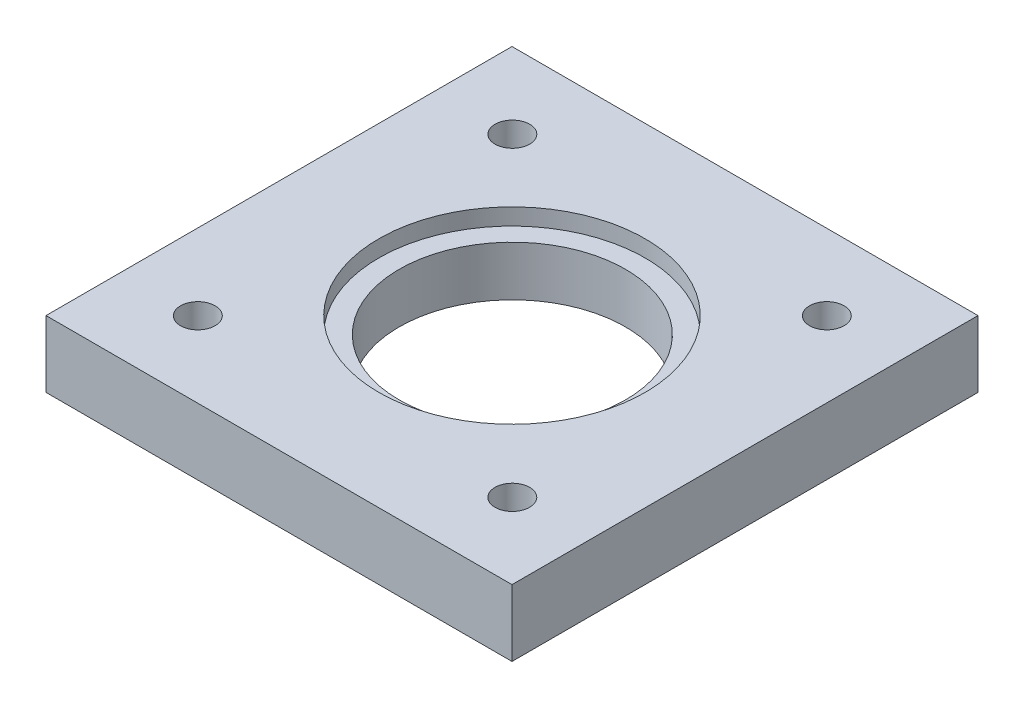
SolidWorks part; units mm, degrees
ref_plane "Front Plane" through (0, 0, 0) normal (0, 0, 1) x (1, 0, 0)
ref_plane "Top Plane" through (0, 0, 0) normal (0, 1, 0) x (1, 0, 0)
ref_plane "Right Plane" through (0, 0, 0) normal (1, 0, 0) x (0, 0, -1)
sketch "Sketch1" plane through (0, 0, 0) normal (0, 1, 0) x (1, 0, 0)
  line L1 (-38.3071, 32.6575) -> (31.6929, 32.6575)
  line L2 (-38.3071, 32.6575) -> (-38.3071, -37.3425)
  line L3 (-38.3071, -37.3425) -> (31.6929, -37.3425)
  line L4 (31.6929, 32.6575) -> (31.6929, -37.3425)
  dimension "D1" = 70
  dimension "D2" = 70
extrude "Boss-Extrude1" add sketch "Sketch1" along normal blind 10
sketch "Sketch2" plane through (0, 10, 0) normal (0, 1, 0) x (1, 0, 0)
  line L0 (-3.3071, 32.6575) -> (-3.3071, -37.3425) construction
  line L1 (31.6929, 32.6575) -> (-38.3071, 32.6575) construction
  line L2 (-38.3071, -37.3425) -> (31.6929, -37.3425) construction
  line L3 (-26.8771, 21.2795) -> (20.3629, 21.2795) construction
  line L4 (-38.3071, -2.3425) -> (31.6929, -2.3425) construction
  line L5 (-38.3071, 32.6575) -> (-38.3071, -37.3425) construction
  line L6 (31.6929, -37.3425) -> (31.6929, 32.6575) construction
  circle A0 centre (-26.8771, 21.2795) radius 2.6
  circle A1 centre (20.3629, 21.2795) radius 2.6
  circle A2 centre (20.3629, -25.9645) radius 2.6
  circle A3 centre (-26.8771, -25.9645) radius 2.6
  dimension "D2" = 5.2
  dimension "D3" = 2
  dimension "D1" = 23.57
  dimension "D5" = 47.24
  dimension "D6" = 47.244
  dimension "D7" = 23.622
  dimension "D4" = 2
extrude "Cut-Extrude1" cut sketch "Sketch2" against normal through all
sketch "Sketch3" plane through (0, 10, 0) normal (0, 1, 0) x (1, 0, 0)
  line L0 (-38.3071, 32.6575) -> (-38.3071, -37.3425) construction
  line L1 (-38.3071, -37.3425) -> (31.6929, -37.3425) construction
  circle A0 centre (-3.3071, -2.3425) radius 20
  dimension "D1" = 40
  dimension "D2" = 35
  dimension "D3" = 35
extrude "Cut-Extrude2" cut sketch "Sketch3" against normal blind 2.5
sketch "Sketch4" plane through (0, 7.5, 0) normal (0, 1, 0) x (1, 0, 0)
  line L0 (-38.3071, -37.3425) -> (31.6929, -37.3425) construction
  line L1 (-38.3071, 32.6575) -> (-38.3071, -37.3425) construction
  circle A0 centre (-3.3071, -2.2905) radius 17
  dimension "D1" = 34
  dimension "D2" = 35
  dimension "D3" = 35.052
extrude "Cut-Extrude3" cut sketch "Sketch4" against normal through all
equation "\"Torque\"= 20'Nm"
equation "\"Safety Factor\"= 4"
equation "\"n\"= 4"
equation "\"Bearing stress\"= 0.408'N/mm^2"
equation "\"db\"= 5.2'mm"
equation "\"t\"=  ( \"F\" )  /  ( \"db\" * \"Bearing stress\" * \"Safety Factor\" ) 'mm"
equation "\"r\"= 0.02357'm"
equation "\"F\"= ( \"Torque\" ) / ( \"n\" * \"r\" )'N"
